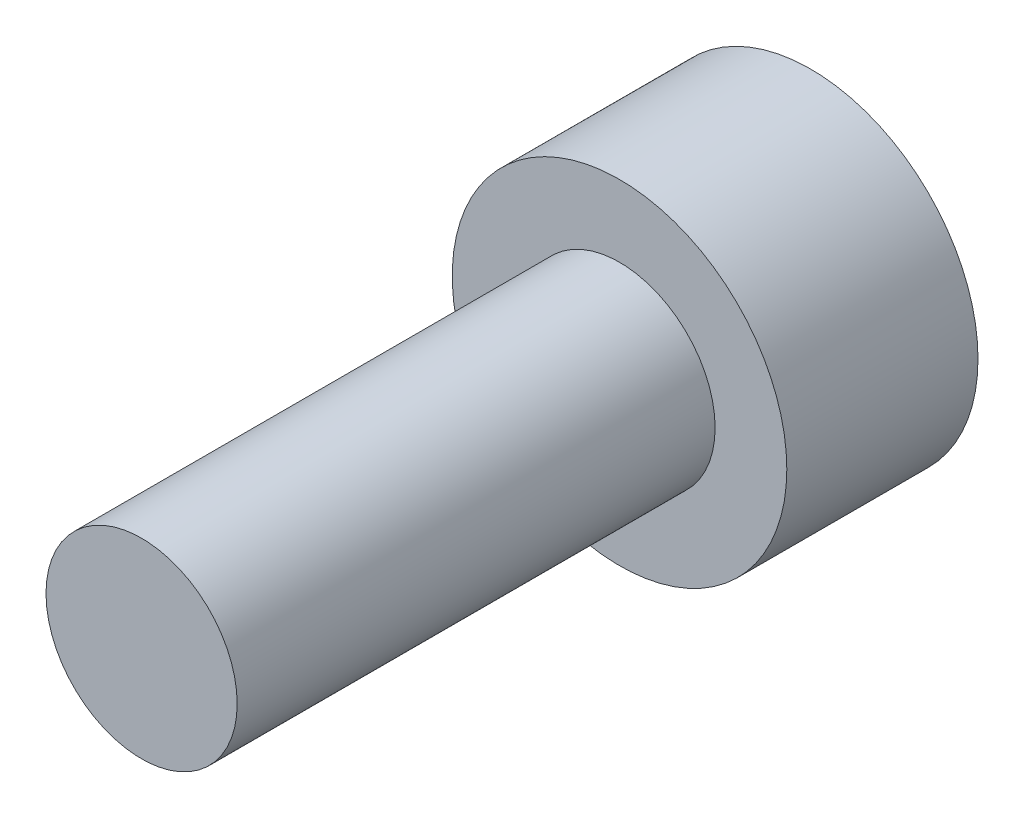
SolidWorks part; units mm, degrees
ref_plane "Front Plane" through (0, 0, 0) normal (0, 0, 1) x (1, 0, 0)
ref_plane "Top Plane" through (0, 0, 0) normal (0, 1, 0) x (1, 0, 0)
ref_plane "Right Plane" through (0, 0, 0) normal (1, 0, 0) x (0, 0, -1)
sketch "Sketch6" plane through (0, 0, 0) normal (1, 0, 0) x (0, 0, -1)
  line L0 (-10, 0) -> (22.525, 0) construction
  line L1 (3.85, 0) -> (-3.85, 0) construction
  line L2 (-10, 0) -> (-10, -2)
  line L3 (-10, -2) -> (0, -2)
  line L4 (0, 3.85) -> (0, -3.85) construction
  line L5 (0, -2) -> (0, -3.5)
  line L6 (0, -3.5) -> (4, -3.5)
  line L7 (4, -3.5) -> (4, 0)
  line L8 (4, 0) -> (-10, 0)
  dimension "L" = 10
  dimension "H" = 4
  dimension "A" = 7
  dimension "D" = 4
revolve "Revolve1" add sketch "Sketch6" angle 360 about L0
sketch "Sketch7" plane through (0, 0, -4) normal (0, 0, -1) x (-1, 0, 0)
  line L2 (-1.5, 0.866) -> (-1.5, -0.866)
  line L4 (-1.5, -0.866) -> (0, -1.7321)
  line L5 (0, -1.7321) -> (1.5, -0.866)
  line L6 (1.5, -0.866) -> (1.5, 0.866)
  line L7 (1.5, 0.866) -> (0, 1.7321)
  line L8 (0, 1.7321) -> (-1.5, 0.866)
  circle A0 centre (0, 0) radius 1.5 construction
  dimension "J" = 3
extrude "HEX" cut sketch "Sketch7" against normal blind 3
